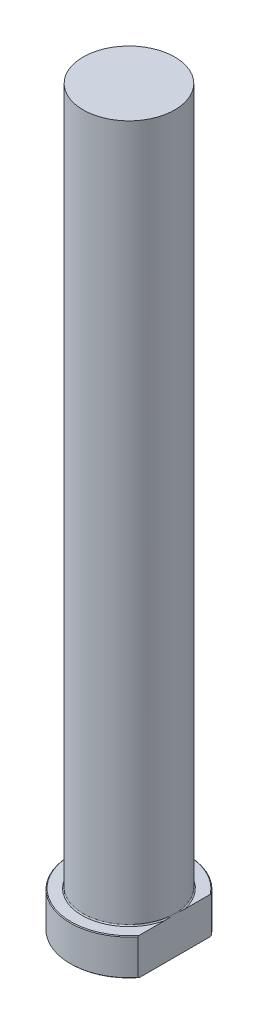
SolidWorks part; units mm, degrees
ref_plane "Front Plane" through (0, 0, 0) normal (0, 0, 1) x (1, 0, 0)
ref_plane "Top Plane" through (0, 0, 0) normal (0, 1, 0) x (1, 0, 0)
ref_plane "Right Plane" through (0, 0, 0) normal (1, 0, 0) x (0, 0, -1)
sketch "Sketch1" plane through (0, 0, 0) normal (0, 0, 1) x (1, 0, 0)
  line L0 (0, 259.9588) -> (0, -15.1925) construction
  line L1 (0, 0) -> (-16, 0)
  line L2 (-16, 0) -> (-16, 10)
  line L3 (-16, 10) -> (-12.5, 10)
  line L4 (-12.5, 10) -> (-12.5, 200)
  line L5 (-12.5, 200) -> (0, 200)
  line L6 (0, 200) -> (0, 0)
  dimension "L" = 200
  dimension "H" = 32
  dimension "T" = 10
  dimension "D" = 25
revolve "Revolve1" add sketch "Sketch1" angle 360 about L0
chamfer "Chamfer1" distance 0.2 angle 45 2 edges at (0, 10, 16) (0, 0, 16)
fillet "Fillet1" radius 0.3 1 edges at (0, 10, 12.5)
sketch "Sketch2" plane through (0, 0, 0) normal (0, 1, 0) x (1, 0, 0)
  line L0 (12.5, 9.9875) -> (12.5, -9.9875)
  circle A0 centre (0, 0) radius 16 construction
  arc A1 (12.5, -9.9875) -> (12.5, 9.9875) centre (0, 0) ccw
  circle A2 centre (0, 0) radius 12.5 construction
extrude "KEY" cut sketch "Sketch2" along normal through all
